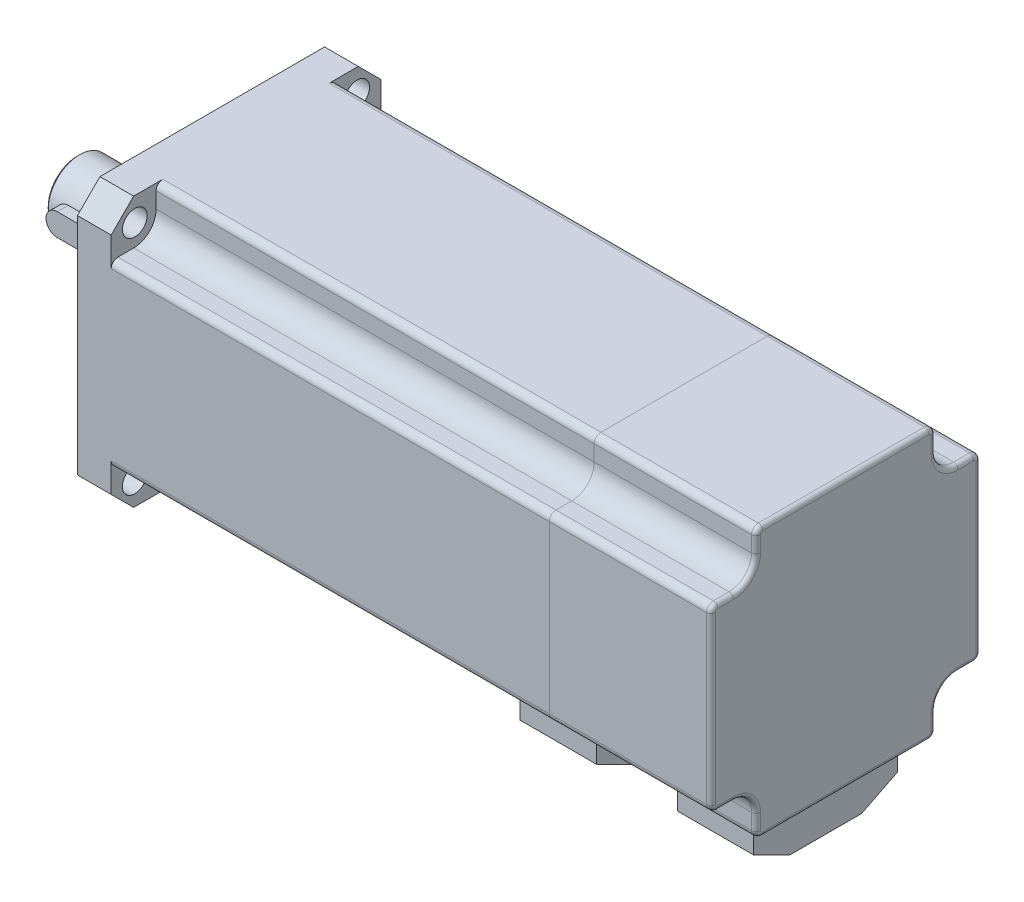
SolidWorks part; units mm, degrees
ref_plane "前视基准面" through (0, 0, 0) normal (0, 0, 1) x (1, 0, 0)
ref_plane "上视基准面" through (0, 0, 0) normal (0, 1, 0) x (1, 0, 0)
ref_plane "右视基准面" through (0, 0, 0) normal (1, 0, 0) x (0, 0, -1)
sketch "草图1" plane through (0, 0, 0) normal (1, 0, 0) x (0, 0, -1)
  line L0 (-30, 25) -> (-25, 30)
  line L1 (-25, -30) -> (25, -30)
  line L2 (-30, -25) -> (-30, 25)
  line L3 (-25, 30) -> (25, 30)
  line L4 (30, -25) -> (30, 25)
  line L5 (-30, -30) -> (30, 30) construction
  line L6 (-30, 30) -> (30, -30) construction
  line L7 (25, 30) -> (30, 25)
  line L8 (25, -30) -> (30, -25)
  line L9 (-30, -25) -> (-25, -30)
  point P0 (0, 0)
extrude "凸台-拉伸1" add sketch "草图1" along normal blind 105
sketch "草图2" plane through (105, 0, 0) normal (1, 0, 0) x (0, 0, -1)
  line L0 (25, 30) -> (-25, 30) construction
  line L1 (-25, -30) -> (25, -30)
  line L2 (-30, -25) -> (-30, 25)
  line L3 (-25, 30) -> (25, 30)
  line L4 (30, -25) -> (30, 25)
  line L5 (-30, -30) -> (30, 30) construction
  line L6 (-30, 30) -> (30, -30) construction
  line L7 (-30, 25) -> (-25, 30)
  line L8 (-30, -25) -> (-25, -30)
  line L9 (25, -30) -> (30, -25)
  line L10 (25, 30) -> (30, 25)
  point P0 (0, 0)
extrude "凸台-拉伸2" add sketch "草图2" along normal blind 36 separate body
sketch "草图3" plane through (141, 0, 0) normal (1, 0, 0) x (0, 0, -1)
  line L0 (-25, 20) -> (-28.5, 20)
  line L1 (-30, 18.5) -> (-30, 25)
  line L2 (-30, 25) -> (-25, 30)
  line L3 (-25, 30) -> (-18.5, 30)
  line L4 (18.5, 30) -> (25, 30)
  line L5 (25, 30) -> (30, 25)
  line L6 (30, 25) -> (30, 18.5)
  line L7 (-30, 25) -> (-30, -25) construction
  line L9 (-28.5, -20) -> (-25, -20)
  line L10 (30, -18.5) -> (30, -25)
  line L11 (-20, -25) -> (-20, -28.5)
  line L12 (-25, -30) -> (25, -30) construction
  line L14 (20, -28.5) -> (20, -25)
  line L15 (30, -25) -> (25, -30)
  line L16 (25, -20) -> (28.5, -20)
  line L17 (30, -25) -> (30, 25) construction
  line L19 (28.5, 20) -> (25, 20)
  line L20 (25, -30) -> (18.5, -30)
  line L21 (20, 25) -> (20, 28.5)
  line L23 (-18.5, -30) -> (-25, -30)
  line L24 (-20, 25) -> (-20, 28.5)
  line L25 (25, 30) -> (-25, 30) construction
  line L27 (-25, -30) -> (-30, -25)
  line L28 (-30, -25) -> (-30, -18.5)
  arc A0 (-25, 20) -> (-20, 25) centre (-25, 25) ccw
  arc A1 (20, 25) -> (25, 20) centre (25, 25) ccw
  arc A2 (25, -20) -> (20, -25) centre (25, -25) ccw
  arc A3 (-20, -25) -> (-25, -20) centre (-25, -25) ccw
  arc A4 (-30, -18.5) -> (-28.5, -20) centre (-28.5, -18.5) ccw
  arc A5 (-20, -28.5) -> (-18.5, -30) centre (-18.5, -28.5) ccw
  arc A6 (18.5, -30) -> (20, -28.5) centre (18.5, -28.5) ccw
  arc A7 (28.5, -20) -> (30, -18.5) centre (28.5, -18.5) ccw
  arc A8 (30, 18.5) -> (28.5, 20) centre (28.5, 18.5) ccw
  arc A9 (20, 28.5) -> (18.5, 30) centre (18.5, 28.5) ccw
  arc A10 (-20, 28.5) -> (-18.5, 30) centre (-18.5, 28.5) cw
  arc A11 (-28.5, 20) -> (-30, 18.5) centre (-28.5, 18.5) ccw
  point P0 (0, 0)
  point P10 (-30, -20)
  point P39 (-20, -30)
  point P42 (20, -30)
  point P45 (30, -20)
  point P48 (30, 20)
  point P53 (-20, 30)
  point P56 (-30, 20)
  dimension "D1" = 1.5
extrude "切除-拉伸1" cut sketch "草图3" against normal blind 133.5
fillet "圆角1" radius 1 24 edges at (141, 19.5607, 29.5607) (141, 20, 26.75) (141, 21.4645, 21.4645) (141, 26.75, 20) (141, 29.5607, 19.5607) (141, 30, 0) (141, 29.5607, -19.5607) (141, 26.75, -20) (141, 21.4645, -21.4645) (141, 20, -26.75) (141, 19.5607, -29.5607) (141, 0, -30) (141, -19.5607, -29.5607) (141, -20, -26.75) (141, -21.4645, -21.4645) (141, -26.75, -20) (141, -29.5607, -19.5607) (141, -30, 0) (141, -29.5607, 19.5607) (141, -26.75, 20) (141, -21.4645, 21.4645) (141, -20, 26.75) (141, -19.5607, 29.5607) (141, 0, 30)
sketch "草图4" plane through (0, 0, 0) normal (-1, 0, 0) x (0, 0, 1)
  circle A1 centre (-24.7487, 24.7487) radius 2.75
  circle A2 centre (24.7487, 24.7487) radius 2.75
  circle A3 centre (-24.7487, -24.7487) radius 2.75
  circle A4 centre (24.7487, -24.7487) radius 2.75
extrude "切除-拉伸2" cut sketch "草图4" against normal blind 7.5
sketch "草图5" plane through (0, 0, 0) normal (-1, 0, 0) x (0, 0, 1)
  circle A0 centre (0, 0) radius 25
  circle A1 centre (0, 0) radius 22.5
extrude "凸台-拉伸3" add sketch "草图5" along normal blind 3 separate body
sketch "草图6" plane through (0, 0, 0) normal (-1, 0, 0) x (0, 0, 1)
  circle A0 centre (0, 0) radius 7.5
extrude "凸台-拉伸4" add sketch "草图6" along normal blind 5
fillet "圆角2" radius 0.5 1 edges at (-5, 0, 7.5)
sketch "草图7" plane through (-5, 0, 0) normal (-1, 0, 0) x (0, 0, 1)
  circle A0 centre (0, 0) radius 7
  point P3 (0, 0)
extrude "凸台-拉伸5" add sketch "草图7" along normal blind 25
chamfer "倒角1" distance 0.5 angle 45 1 edges at (-30, 0, 7)
ref_plane "基准面1" through (0, 0, 7) normal (0, 0, 1) x (1, 0, 0)
sketch "草图8" plane through (0, 0, 7) normal (0, 0, 1) x (1, 0, 0)
  line L3 (-25.5, 2.5) -> (-10, 2.5)
  line L5 (-10, -2.5) -> (-25.5, -2.5)
  arc A0 (-25.5, 2.5) -> (-25.5, -2.5) centre (-25.5, 0) ccw
  arc A1 (-10, -2.5) -> (-10, 2.5) centre (-10, 0) ccw
extrude "切除-拉伸3" cut sketch "草图8" against normal blind 3
sketch "草图9" plane through (0, 0, 4) normal (0, 0, 1) x (1, 0, 0)
  line L0 (-25.5, 2.5) -> (-10, 2.5)
  line L2 (-10, -2.5) -> (-25.5, -2.5)
  arc A0 (-25.5, 2.5) -> (-25.5, -2.5) centre (-25.5, 0) ccw
  arc A1 (-10, -2.5) -> (-10, 2.5) centre (-10, 0) ccw
extrude "凸台-拉伸6" add sketch "草图9" along normal blind 5 separate body
sketch "草图10" plane through (0, -30, 0) normal (0, -1, 0) x (-1, 0, 0)
  line L6 (-84.5, 16) -> (-101.5, 16)
  line L7 (-84.5, 16) -> (-84.5, -16)
  line L8 (-84.5, -16) -> (-101.5, -16)
  line L10 (-101.5, 16) -> (-101.5, -16)
  line L17 (-119.5, 16) -> (-136.5, 16)
  line L18 (-119.5, 16) -> (-119.5, -16)
  line L19 (-119.5, -16) -> (-136.5, -16)
  line L20 (-136.5, 16) -> (-136.5, -16)
  line L21 (-119.5, 16) -> (-136.5, -16) construction
  line L22 (-119.5, -16) -> (-136.5, 16) construction
  line L23 (-84.5, 16) -> (-101.5, -16) construction
  line L24 (-84.5, -16) -> (-101.5, 16) construction
extrude "凸台-拉伸7" add sketch "草图10" along normal blind 11 separate body
sketch "草图13" plane through (84.5, 0, 0) normal (-1, 0, 0) x (0, 0, 1)
  line L0 (-16, -41) -> (-16, -37)
  line L1 (-16, -41) -> (-16, -30) construction
  line L2 (-16, -41) -> (-8, -41)
  line L3 (16, -41) -> (16, -37)
  line L4 (16, -41) -> (16, -30) construction
  line L5 (16, -41) -> (8, -41)
  line L6 (16, -41) -> (-16, -41) construction
  line L7 (-16, -37) -> (-8, -41)
  line L8 (8, -41) -> (16, -37)
extrude "切除-拉伸5" cut sketch "草图13" against normal blind 52
